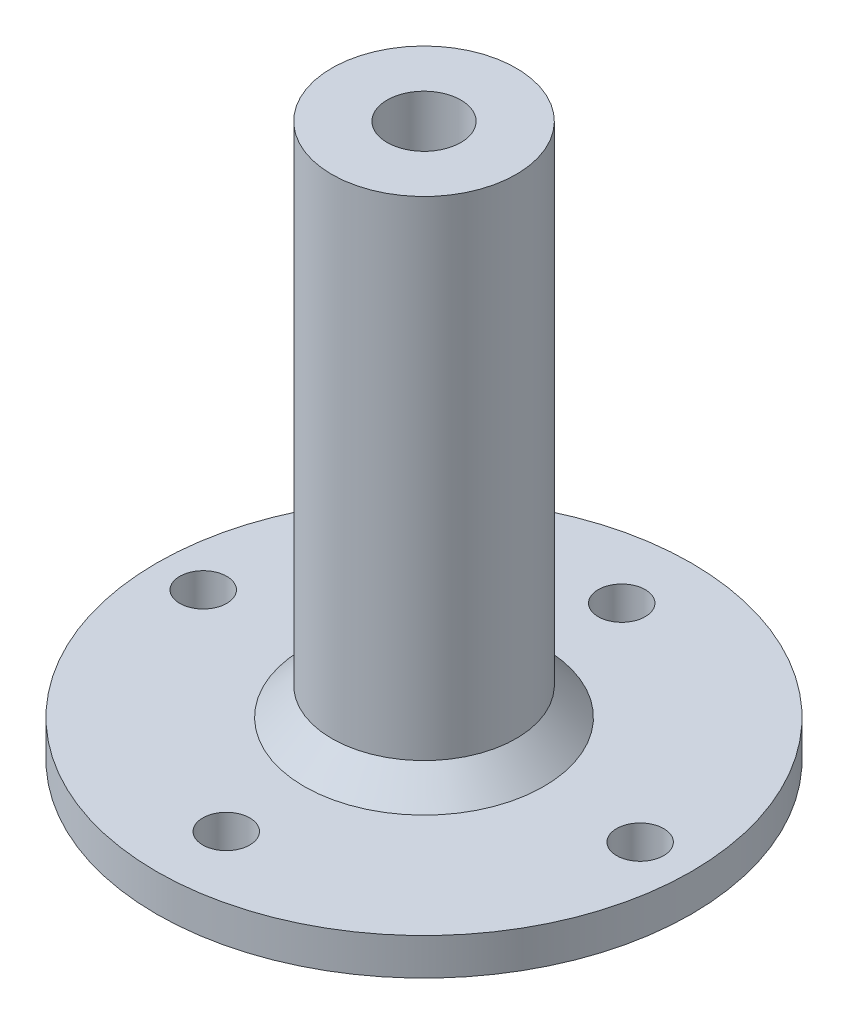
SolidWorks part; units mm, degrees
ref_plane "Front Plane" through (0, 0, 0) normal (0, 0, 1) x (1, 0, 0)
ref_plane "Top Plane" through (0, 0, 0) normal (0, 1, 0) x (1, 0, 0)
ref_plane "Right Plane" through (0, 0, 0) normal (1, 0, 0) x (0, 0, -1)
sketch "Sketch1" plane through (0, 0, 0) normal (0, 1, 0) x (1, 0, 0)
  line L0 (-29, 0) -> (29, 0) construction
  line L1 (0, -29) -> (0, 29) construction
  line L2 (-23.95, 0) -> (23.45, 0) construction
  circle A0 centre (0, 0) radius 29
  circle A1 centre (-23.95, 0) radius 2.55
  circle A2 centre (23.45, 0) radius 2.55
  circle A3 centre (0, 21.45) radius 2.55
  circle A4 centre (0, -21.45) radius 2.55
  point P13 (0, 0)
  point P14 (0, 0)
  point P17 (0, 0)
  dimension "D1" = 58
  dimension "D2" = 5.1
  dimension "D3" = 5.1
  dimension "D4" = 5.1
  dimension "D5" = 5.1
  dimension "D6" = 52.5
  dimension "D7" = 26
  dimension "D8" = 48
  dimension "D9" = 24
extrude "Boss-Extrude1" add sketch "Sketch1" along normal blind 4
sketch "Sketch2" plane through (0, 4, 0) normal (0, 1, 0) x (1, 0, 0)
  circle A0 centre (0, 0) radius 10
  dimension "D1" = 20
extrude "Boss-Extrude2" add sketch "Sketch2" along normal blind 56
chamfer "Chamfer1" distance 3 angle 45 1 edges at (0, 4, 10)
sketch "Sketch3" plane through (0, 60, 0) normal (0, 1, 0) x (1, 0, 0)
  circle A0 centre (0, 0) radius 4
  dimension "D1" = 8
extrude "Cut-Extrude1" cut sketch "Sketch3" against normal through all
